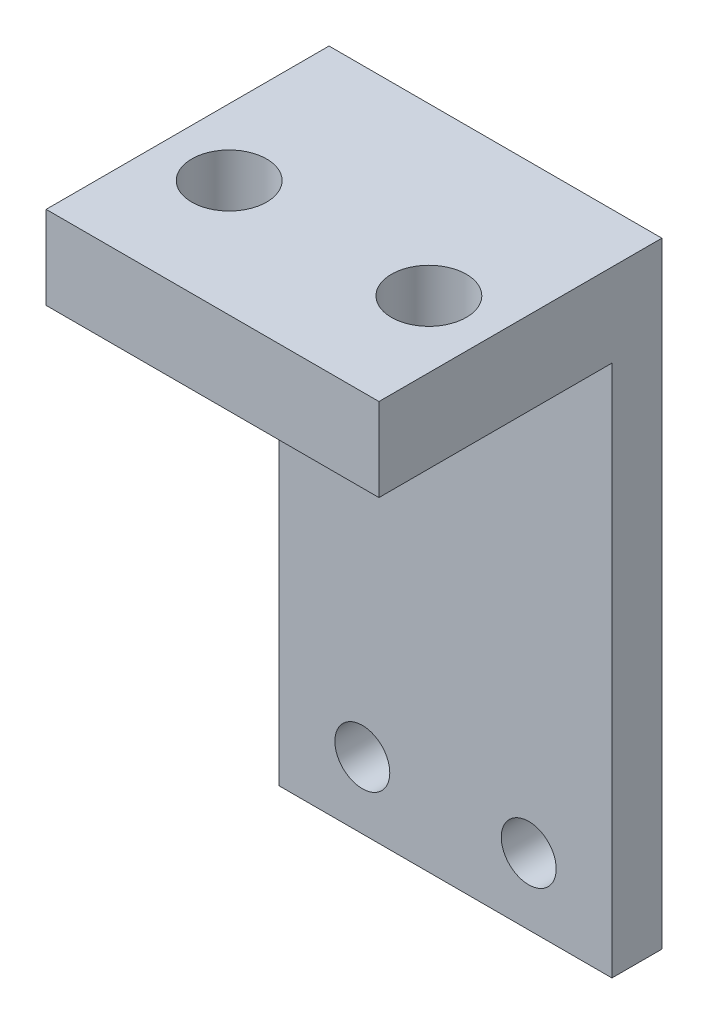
SolidWorks part; units mm, degrees
ref_plane "Piano frontale" through (0, 0, 0) normal (0, 0, 1) x (1, 0, 0)
ref_plane "Piano superiore" through (0, 0, 0) normal (0, 1, 0) x (1, 0, 0)
ref_plane "Piano destro" through (0, 0, 0) normal (1, 0, 0) x (0, 0, -1)
sketch "Schizzo1" plane through (0, 0, 0) normal (0, 0, 1) x (1, 0, 0)
  line L1 (-10, 2.5) -> (10, 2.5)
  line L2 (-10, 2.5) -> (-10, -2.5)
  line L3 (-10, -2.5) -> (10, -2.5)
  line L4 (10, 2.5) -> (10, -2.5)
  line L5 (-10, 2.5) -> (10, -2.5) construction
  line L6 (-10, -2.5) -> (10, 2.5) construction
  point P0 (0, 0)
  dimension "D1" = 20
  dimension "D2" = 5
extrude "Estrusione-Estrusione1" add sketch "Schizzo1" along normal blind 17
sketch "Schizzo2" plane through (0, -2.5, 0) normal (0, -1, 0) x (1, 0, 0)
  line L0 (10, 17) -> (10, 0) construction
  line L1 (-10, 0) -> (10, 0)
  line L2 (-10, 0) -> (-10, 3)
  line L3 (-10, 3) -> (10, 3)
  line L4 (10, 0) -> (10, 3)
  dimension "D1" = 3
extrude "Estrusione-Estrusione2" add sketch "Schizzo2" along normal blind 32
hole_wizard "Foro filettato M4-1" positions "Schizzo3" profile "Schizzo4" tap size "M4" standard "ISO"
sketch "Schizzo3" plane through (0, 0, 3) normal (0, 0, 1) x (1, 0, 0)
  line L0 (-10, -34.5) -> (-10, -2.5) construction
  line L2 (10, -34.5) -> (-10, -34.5) construction
  point P0 (-5, -30.5)
  point P2 (5, -30.5)
  dimension "D1" = 10
  dimension "D2" = 5
  dimension "D3" = 4
sketch "Schizzo4" plane through (-5, -30.5, 3) normal (1, 0, 0) x (0, -1, 0)
  line L0 (0, 0) -> (0, 3)
  line L1 (0, 3) -> (1.65, 3)
  line L2 (1.65, 3) -> (1.65, 0)
  line L5 (1.65, 0) -> (0, 0)
  line L11 (0, -6.35) -> (0, 107.95) construction
  dimension "Thru Tap Drill Dia." = 3.3
  dimension "Thru Tap Drill Depth" = 3
sketch "Schizzo5" plane through (0, 2.5, 0) normal (0, 1, 0) x (1, 0, 0)
  line L0 (0, 2.1069) -> (0, -18.2528) construction
  line L1 (-10, -17) -> (-10, 0) construction
  circle A0 centre (-5, -9.3268) radius 3.3
  circle A1 centre (5, -9.3268) radius 3.3
extrude "Taglio-Estrusione1" [suppressed] cut sketch "Schizzo5" against normal up to next
hole_wizard "Foro per Vite M4-1" positions "Schizzo6" profile "Schizzo7" hole size "M4" standard "ISO"
sketch "Schizzo6" plane through (0, 2.5, 0) normal (0, 1, 0) x (1, 0, 0)
  point P0 (-6, -10)
  point P2 (6, -10)
  point P6 (0, 0)
  dimension "D1" = 12
  dimension "D2" = 6
  dimension "D3" = 10
sketch "Schizzo7" plane through (-6, 2.5, 10) normal (1, 0, 0) x (0, 0, 1)
  line L0 (0, 0) -> (0, 37)
  line L1 (0, 37) -> (2.25, 37)
  line L2 (2.25, 37) -> (2.25, 0)
  line L5 (2.25, 0) -> (0, 0)
  line L11 (0, -6.35) -> (0, 107.95) construction
  dimension "Thru Hole Dia." = 4.5
  dimension "Thru Hole Depth" = 37
equation "\"D1@Schizzo5\"=6+0.1*6"
